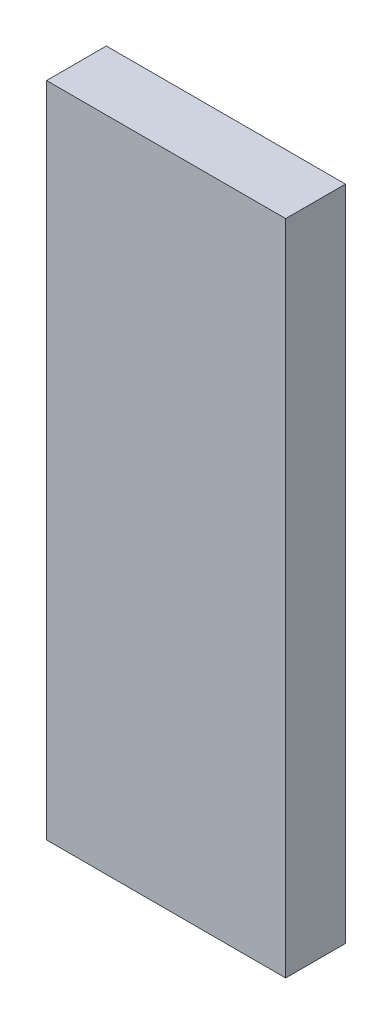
SolidWorks part; units mm, degrees
ref_plane "Plan de face" through (0, 0, 0) normal (0, 0, 1) x (1, 0, 0)
ref_plane "Plan de dessus" through (0, 0, 0) normal (0, 1, 0) x (1, 0, 0)
ref_plane "Plan de droite" through (0, 0, 0) normal (1, 0, 0) x (0, 0, -1)
sketch "Esquisse1" plane through (0, 0, 0) normal (0, 0, 1) x (1, 0, 0)
  line L0 (0, 17.5) -> (0, -17.5) construction
  dimension "D1" = 35
  dimension "D2" = 17.5
sketch "Esquisse2" plane through (0, 0, 0) normal (0, 0, 1) x (1, 0, 0)
  line L0 (0, 17.5) -> (0, -17.5) construction
  line L1 (-10, 27.5) -> (10, 27.5)
  line L2 (-10, 27.5) -> (-10, -27.5)
  line L3 (-10, -27.5) -> (10, -27.5)
  line L4 (10, 27.5) -> (10, -27.5)
  dimension "D1" = 20
  dimension "D2" = 10
  dimension "D3" = 55
  dimension "D4" = 27.5
extrude "Boss.-Extru.1" add sketch "Esquisse2" along normal blind 5
